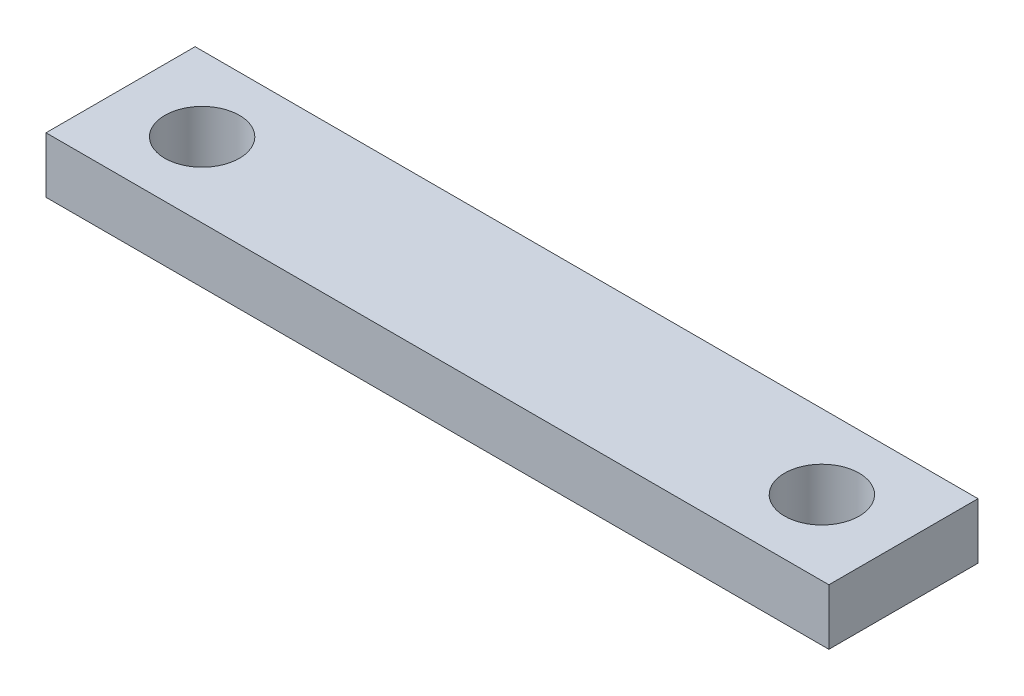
SolidWorks part; units mm, degrees
ref_plane "Front" through (0, 0, 0) normal (0, 0, 1) x (1, 0, 0)
ref_plane "Top" through (0, 0, 0) normal (0, 1, 0) x (1, 0, 0)
ref_plane "Right" through (0, 0, 0) normal (1, 0, 0) x (0, 0, -1)
sketch "Sketch1" plane through (0, 0, 0) normal (0, 1, 0) x (1, 0, 0)
  line L0 (0, -50) -> (0, 50) construction
  line L1 (-66.675, 12.7) -> (66.675, 12.7)
  line L2 (-66.675, 12.7) -> (-66.675, -12.7)
  line L3 (-66.675, -12.7) -> (66.675, -12.7)
  line L4 (66.675, 12.7) -> (66.675, -12.7)
  line L5 (-50, 0) -> (50, 0) construction
  point P4 (0, 12.7)
  point P7 (66.675, 0)
  dimension "D1" = 25.4
  dimension "D2" = 133.35
extrude "Boss-Extrude1" add sketch "Sketch1" along normal blind 9.525
sketch "Sketch2" plane through (0, 9.525, 0) normal (0, 1, 0) x (1, 0, 0)
  line L0 (-50, 0) -> (50, 0) construction
  line L1 (0, -50) -> (0, 50) construction
  circle A0 centre (52.7812, 0) radius 6.35
  dimension "D1" = 12.7
  dimension "D2" = 52.7812
extrude "Cut-Extrude1" cut sketch "Sketch2" against normal through all
mirror "Mirror1" about plane through (0, 0, 0) normal (1, 0, 0) of "Cut-Extrude1"
